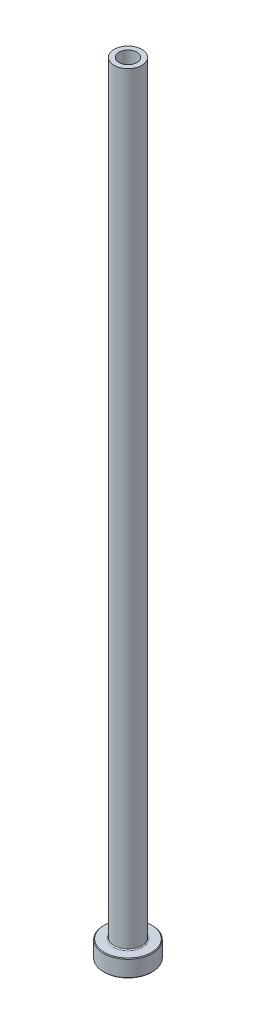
SolidWorks part; units mm, degrees
ref_plane "Front Plane" through (0, 0, 0) normal (0, 0, 1) x (1, 0, 0)
ref_plane "Top Plane" through (0, 0, 0) normal (0, 1, 0) x (1, 0, 0)
ref_plane "Right Plane" through (0, 0, 0) normal (1, 0, 0) x (0, 0, -1)
sketch "Sketch1" plane through (0, 0, 0) normal (0, 0, 1) x (1, 0, 0)
  line L0 (-2.6, 225) -> (-4, 225)
  line L1 (-4, 225) -> (-4, 5)
  line L2 (-4, 5) -> (-7, 5)
  line L3 (-7, 5) -> (-7, 0)
  line L4 (7.7, 0) -> (-7.7, 0) construction
  line L5 (-7, 0) -> (-2.85, 0)
  line L6 (-2.6, 180) -> (-2.6, 225)
  line L7 (0, 92.1877) -> (0, -15.5353) construction
  line L8 (0, -7.7) -> (0, 7.7) construction
  line L9 (-2.6, 180) -> (-2.85, 168)
  line L10 (-2.85, 168) -> (-2.85, 0)
  dimension "D1" = 0.25
  dimension "ID" = 5.2
  dimension "OD" = 8
  dimension "L" = 225
  dimension "H" = 14
  dimension "T" = 5
  dimension "N" = 45
  dimension "D2" = 12
revolve "Revolve1" add sketch "Sketch1" angle 360 about L7
fillet "Fillet1" radius 0.3 1 edges at (0, 5, 4)
chamfer "Chamfer1" distance 0.2 angle 45 2 edges at (0, 5, 7) (0, 0, 7)
chamfer "Chamfer3" distance 0.5 angle 45 1 edges at (0, 0, 2.85)
